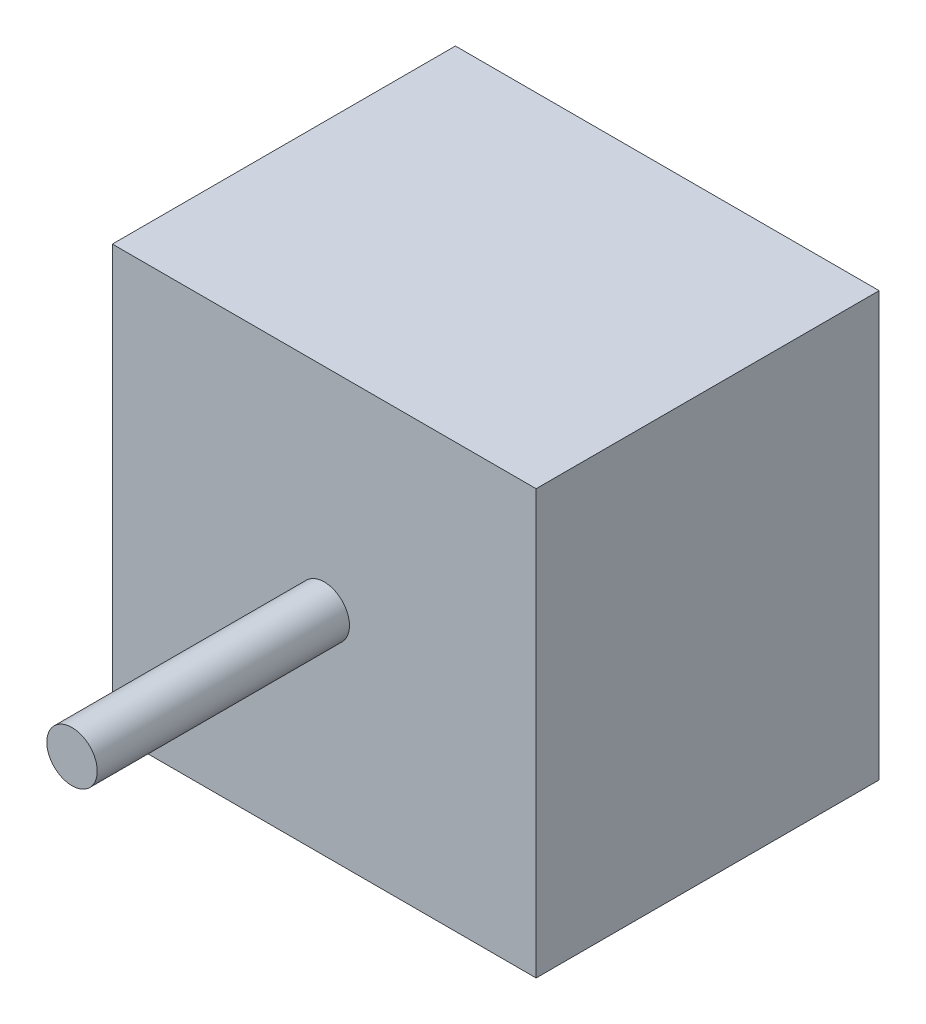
SolidWorks part; units mm, degrees
ref_plane "Front Plane" through (0, 0, 0) normal (0, 0, 1) x (1, 0, 0)
ref_plane "Top Plane" through (0, 0, 0) normal (0, 1, 0) x (1, 0, 0)
ref_plane "Right Plane" through (0, 0, 0) normal (1, 0, 0) x (0, 0, -1)
sketch "Sketch1" plane through (0, 0, 0) normal (0, 0, 1) x (1, 0, 0)
  line L1 (-21, -21) -> (21, -21)
  line L2 (-21, -21) -> (-21, 21)
  line L3 (-21, 21) -> (21, 21)
  line L4 (21, -21) -> (21, 21)
  line L5 (-21, -21) -> (21, 21) construction
  line L6 (-21, 21) -> (21, -21) construction
  point P0 (0, 0)
  dimension "D1" = 21
extrude "Boss-Extrude1" add sketch "Sketch1" against normal blind 34
sketch "Sketch2" plane through (0, 0, 0) normal (0, 0, 1) x (1, 0, 0)
  circle A0 centre (0, 0) radius 2.5
  dimension "D1" = 5
extrude "Boss-Extrude2" add sketch "Sketch2" along normal blind 25
